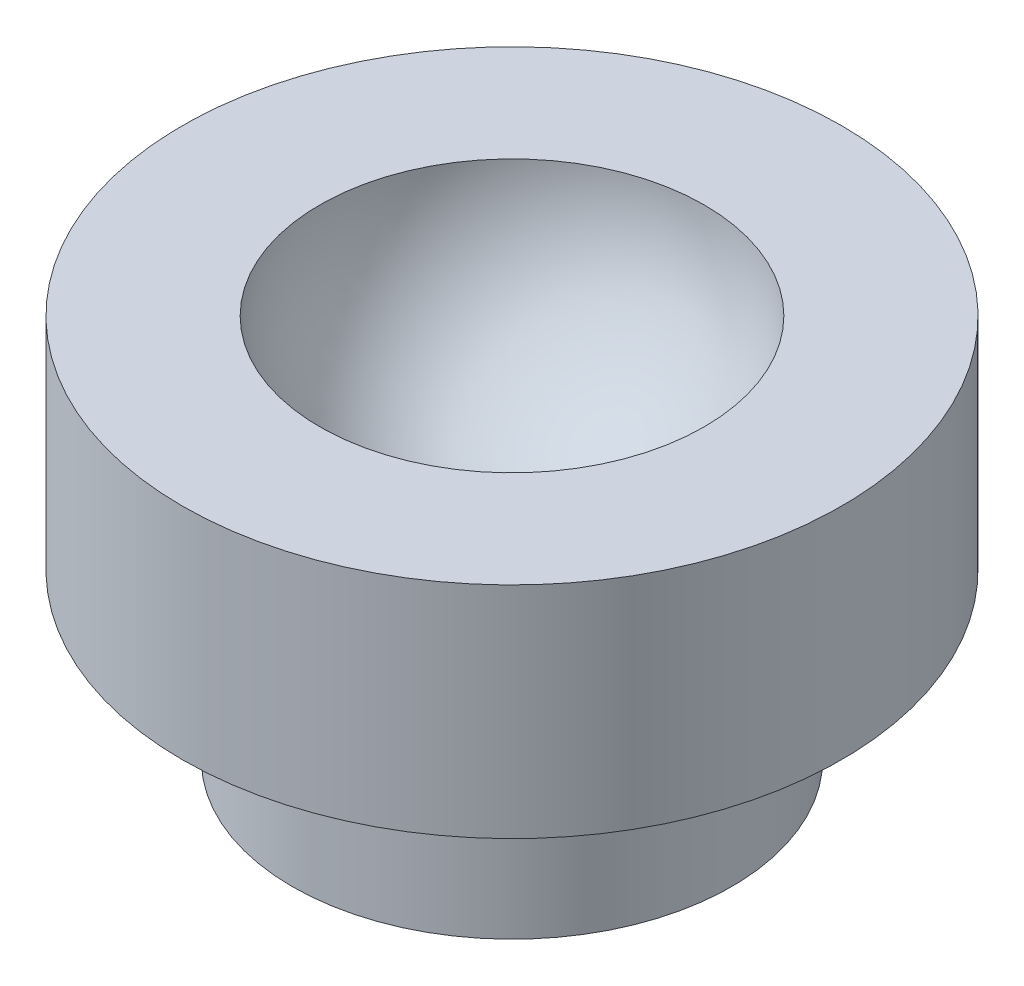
SolidWorks part; units mm, degrees
ref_plane "正面" through (0, 0, 0) normal (0, 0, 1) x (1, 0, 0)
ref_plane "平面" through (0, 0, 0) normal (0, 1, 0) x (1, 0, 0)
ref_plane "右側面" through (0, 0, 0) normal (1, 0, 0) x (0, 0, -1)
sketch "ｽｹｯﾁ1" plane through (0, 0, 0) normal (0, 0, 1) x (1, 0, 0)
  line L0 (0, -25.128) -> (0, 33.9731) construction
  line L1 (0, 0) -> (40, 0)
  line L2 (40, 0) -> (40, 30)
  line L3 (40, 30) -> (60, 30)
  line L4 (60, 30) -> (60, 70)
  line L5 (60, 70) -> (0, 70)
  line L6 (0, 70) -> (0, 0)
  dimension "D1" = 40
  dimension "D2" = 30
  dimension "D3" = 60
  dimension "D4" = 40
revolve "回転1" add sketch "ｽｹｯﾁ1" angle 360 about L0
sketch "ｽｹｯﾁ2" plane through (0, 0, 0) normal (0, 0, 1) x (1, 0, 0)
  line L1 (0, 14.9944) -> (0, 119.1543) construction
  line L2 (60, 70) -> (-60, 70) construction
  line L3 (34.9999, 70) -> (0, 70.0934)
  line L4 (0, 70.0934) -> (0, 35.0934)
  arc A0 (34.9999, 70) -> (0, 35.0934) centre (0, 70.0934) cw
  dimension "D1" = 35
revolve "ｶｯﾄ - 回転3" cut sketch "ｽｹｯﾁ2" angle 360 about L1
